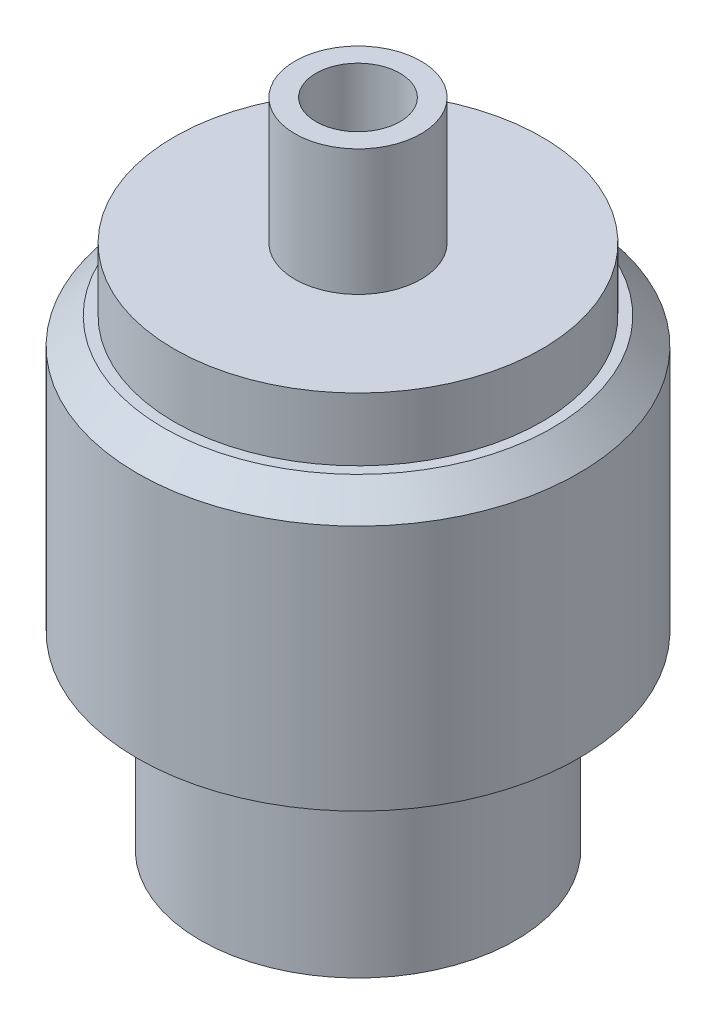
SolidWorks part; units mm, degrees
ref_plane "Přední rovina" through (0, 0, 0) normal (0, 0, 1) x (1, 0, 0)
ref_plane "Horní rovina" through (0, 0, 0) normal (0, 1, 0) x (1, 0, 0)
ref_plane "Pravá rovina" through (0, 0, 0) normal (1, 0, 0) x (0, 0, -1)
sketch "Skica1" plane through (0, 0, 0) normal (0, 1, 0) x (1, 0, 0)
  circle A0 centre (0, 0) radius 10.5
extrude "Přidat vysunutím1" add sketch "Skica1" along normal blind 25
sketch "Skica2" plane through (0, 25, 0) normal (0, 1, 0) x (1, 0, 0)
  circle A0 centre (0, 0) radius 8.75
  dimension "D1" = 17.5
extrude "Odebrat vysunutím1" cut sketch "Skica2" against normal blind 3 flip side to cut
sketch "Skica3" plane through (0, 25, 0) normal (0, 1, 0) x (1, 0, 0)
  circle A0 centre (0, 0) radius 3
extrude "Přidat vysunutím2" add sketch "Skica3" along normal blind 6
sketch "Skica4" plane through (0, 0, 0) normal (0, -1, 0) x (1, 0, 0)
  circle A0 centre (0, 0) radius 7.5
extrude "Odebrat vysunutím2" cut sketch "Skica4" against normal blind 7.5 flip side to cut
chamfer "Zkosení1" distance 1.5 distance2 2.5 1 edges at (0, 7.5, -10.5)
chamfer "Zkosení2" distance 1.25 angle 45 1 edges at (0, 22, 10.5)
hole_wizard "Ø7.0 (7) průměr díry1" positions "Skica6" profile "Skica5" hole size "Ø7.0" standard "DIN"
sketch "Skica6" plane through (0, 0, 0) normal (0, -1, 0) x (1, 0, 0)
  circle A0 centre (0, 0) radius 7.5 construction
  point P0 (0, 0)
  dimension "D1" = 0
sketch "Skica5" plane through (0, 0, 0) normal (1, 0, 0) x (0, 0, -1)
  line L0 (0, 0) -> (0, 22.0207)
  line L1 (0, 22.0207) -> (3.5, 20)
  line L2 (3.5, 20) -> (3.5, 0)
  line L5 (3.5, 0) -> (0, 0)
  line L10 (0, 22.0207) -> (-3.5, 20) construction
  line L11 (0, -6.35) -> (0, 107.95) construction
  dimension "Průměr díry" = 7
  dimension "Hloubka díry" = 20
  dimension "Úhel vrtání" = 120
sketch "Skica7" plane through (0, 31, 0) normal (0, 1, 0) x (1, 0, 0)
  circle A0 centre (0, 0) radius 2
extrude "Odebrat vysunutím3" cut sketch "Skica7" against normal through all
